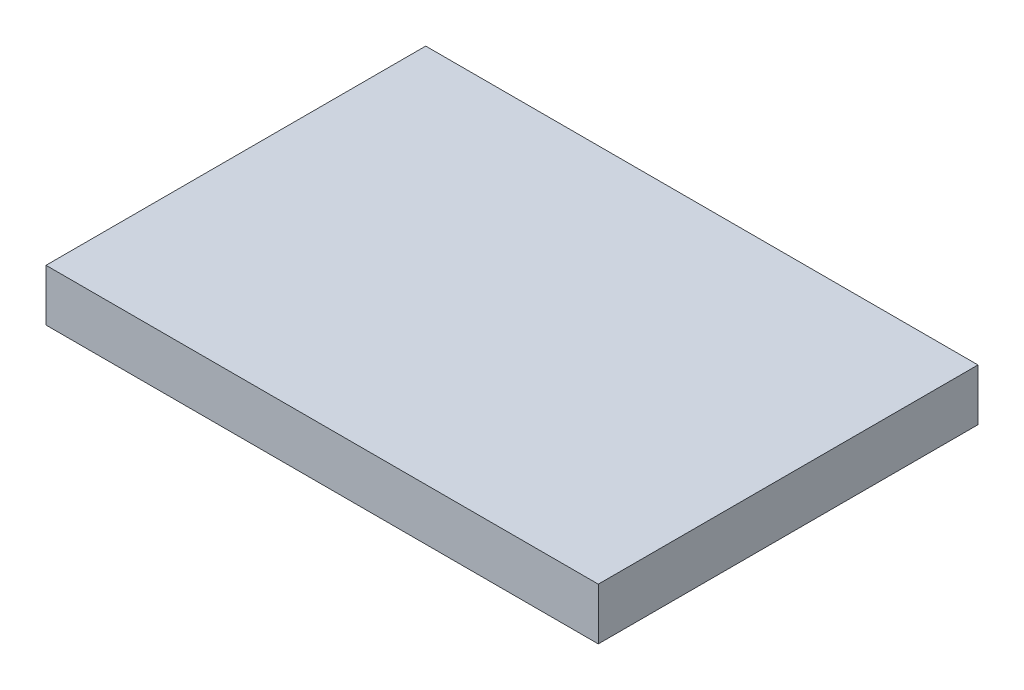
SolidWorks part; units mm, degrees
ref_plane "Front Plane" through (0, 0, 0) normal (0, 0, 1) x (1, 0, 0)
ref_plane "Top Plane" through (0, 0, 0) normal (0, 1, 0) x (1, 0, 0)
ref_plane "Right Plane" through (0, 0, 0) normal (1, 0, 0) x (0, 0, -1)
sketch "Sketch1" plane through (0, 0, 0) normal (0, 0, 1) x (1, 0, 0)
  line L1 (0, 0) -> (203.2, 0)
  line L2 (0, 0) -> (0, 19.05)
  line L3 (0, 19.05) -> (203.2, 19.05)
  line L4 (203.2, 0) -> (203.2, 19.05)
  dimension "D1" = 203.2
  dimension "D2" = 19.05
extrude "Extrude1" add sketch "Sketch1" along normal blind 139.7
sketch "Sketch2" plane through (0, 0, 0) normal (0, -1, 0) x (1, 0, 0)
  line L1 (88.9, 122.2375) -> (114.3, 122.2375)
  line L2 (88.9, 122.2375) -> (88.9, 130.175)
  line L3 (88.9, 130.175) -> (114.3, 130.175)
  line L4 (114.3, 122.2375) -> (114.3, 130.175)
extrude "Cut-Extrude1" cut sketch "Sketch2" against normal up to vertex (0.7937 mm away)
